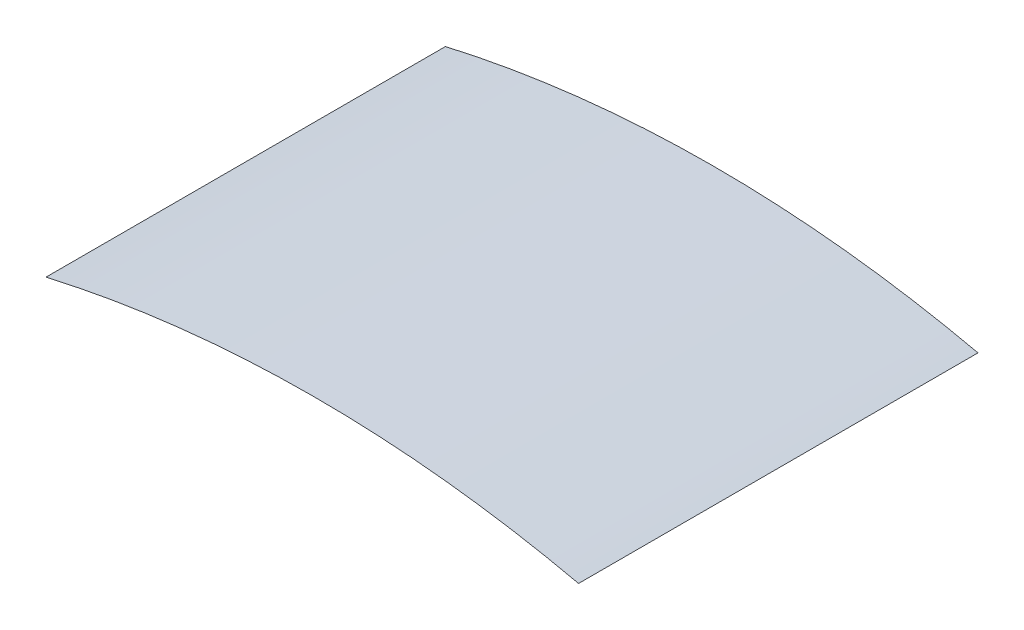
SolidWorks part; units mm, degrees
ref_plane "Ebene vorne" through (0, 0, 0) normal (0, 0, 1) x (1, 0, 0)
ref_plane "Ebene oben" through (0, 0, 0) normal (0, 1, 0) x (1, 0, 0)
ref_plane "Ebene rechts" through (0, 0, 0) normal (1, 0, 0) x (0, 0, -1)
sketch "Skizze1" plane through (0, 0, 0) normal (0, 0, 1) x (1, 0, 0)
  arc A0 (0, 0) -> (-199.9996, -0.3743) centre (-99.1788, -438.9346) ccw
surface "Oberfläche-Linear austragen1" sketch "Skizze1" parameters "D1"=150
